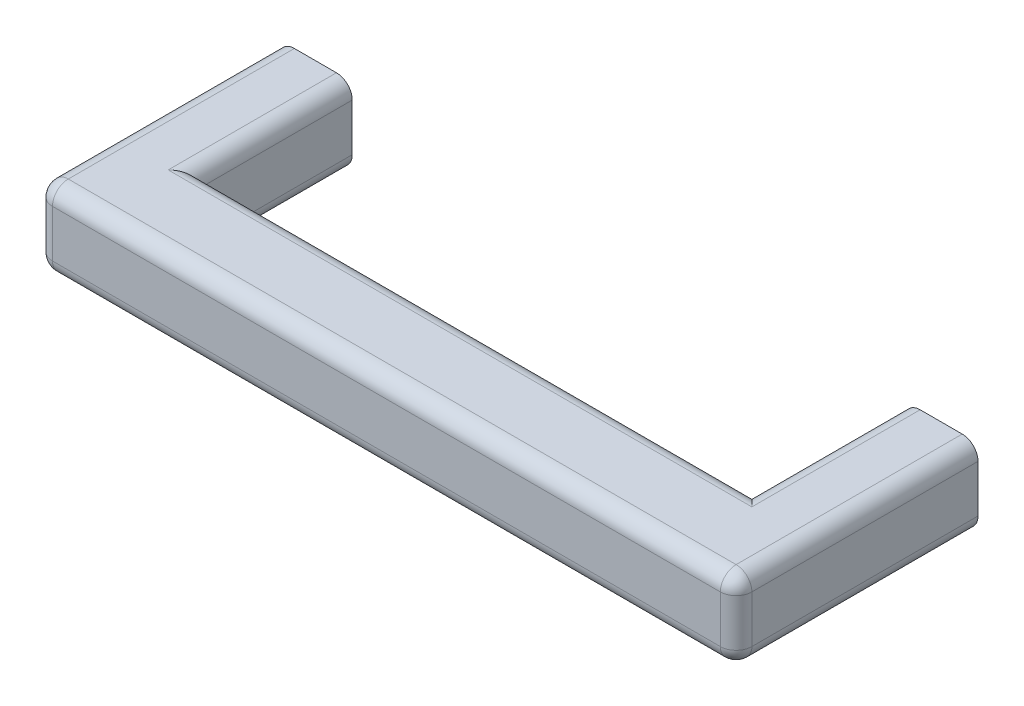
SolidWorks part; units mm, degrees
ref_plane "Ebene vorne" through (0, 0, 0) normal (0, 0, 1) x (1, 0, 0)
ref_plane "Ebene oben" through (0, 0, 0) normal (0, 1, 0) x (1, 0, 0)
ref_plane "Ebene rechts" through (0, 0, 0) normal (1, 0, 0) x (0, 0, -1)
sketch "Skizze1" plane through (0, 0, 0) normal (0, 1, 0) x (1, 0, 0)
  line L0 (0, 86.4595) -> (0, -52.4595) construction
  line L1 (66.5, 0) -> (-66.5, 0)
  line L2 (-66.5, 0) -> (-66.5, 46)
  line L3 (-66.5, 46) -> (-52.5, 46)
  line L4 (-52.5, 46) -> (-52.5, 17)
  line L5 (-52.5, 17) -> (52.5, 17)
  line L6 (52.5, 46) -> (52.5, 17)
  line L7 (66.5, 46) -> (52.5, 46)
  line L8 (66.5, 0) -> (66.5, 46)
  point P10 (0, 17)
  point P13 (0, 0)
  dimension "D1" = 46
  dimension "D2" = 14
  dimension "D3" = 105
  dimension "D4" = 17
extrude "Aufsatz-Linear austragen1" add sketch "Skizze1" along normal blind 15
fillet "Verrundung2" radius 3 14 edges at (52.5, 15, -31.5) (66.5, 15, -23) (66.5, 7.5, 0) (0, 15, 0) (0, 15, -17) (-52.5, 15, -31.5) (-66.5, 15, -23) (-66.5, 7.5, 0) (-66.5, 0, -23) (-52.5, 0, -31.5) (0, 0, 0) (66.5, 0, -23) (0, 0, -17) (52.5, 0, -31.5)
sketch "Skizze2" plane through (0, 0, -46) normal (0, 0, -1) x (-1, 0, 0)
  line L0 (0, 0) -> (0, 19.0724) construction
  line L1 (-66.5, 7.5) -> (-52.5, 7.5) construction
  line L2 (-66.5, 12) -> (-66.5, 3) construction
  line L3 (-52.5, 12) -> (-52.5, 3) construction
  circle A0 centre (-59.5, 7.5) radius 2.0102
  circle A1 centre (59.5, 7.5) radius 2.0102
  dimension "D1" = 119
extrude "Schnitt-Linear austragen1" cut sketch "Skizze2" against normal blind 10
